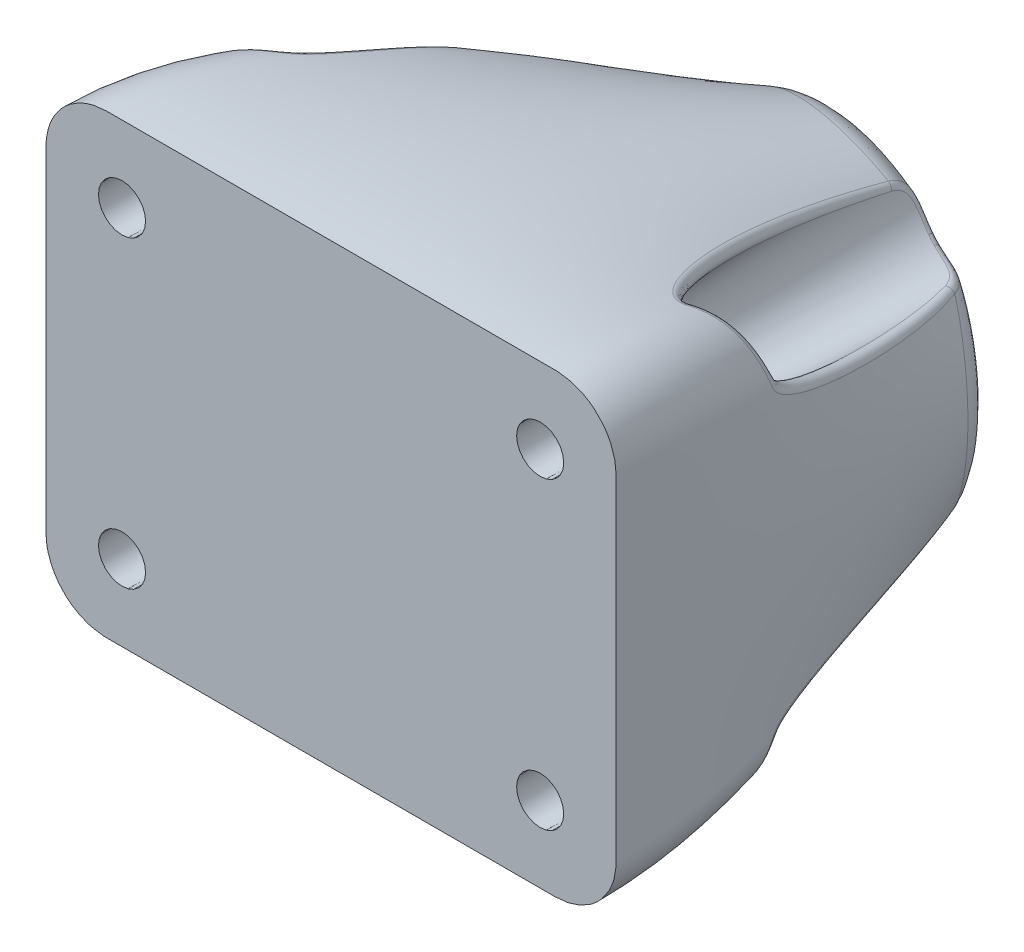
SolidWorks part; units mm, degrees
ref_plane "Front Plane" through (0, 0, 0) normal (0, 0, 1) x (1, 0, 0)
ref_plane "Top Plane" through (0, 0, 0) normal (0, 1, 0) x (1, 0, 0)
ref_plane "Right Plane" through (0, 0, 0) normal (1, 0, 0) x (0, 0, -1)
body saved out of another part "Stock-steering-assembly-1"
